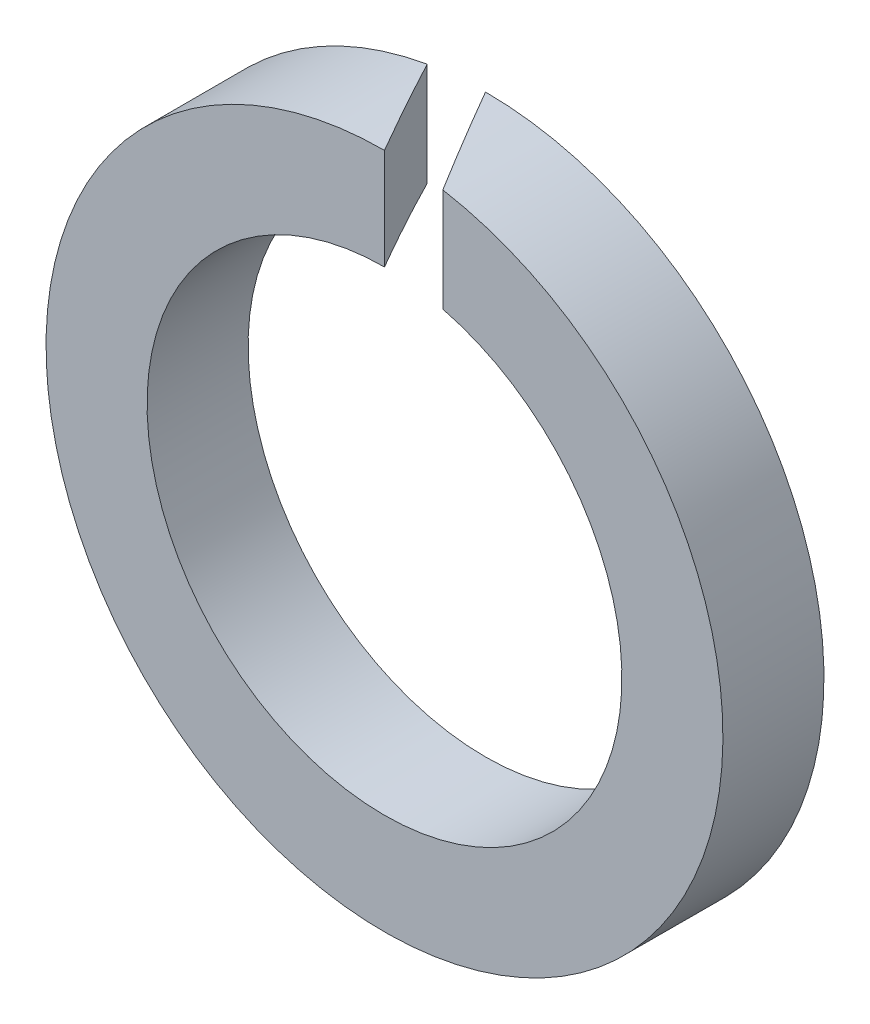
SolidWorks part; units mm, degrees
ref_plane "Front" through (0, 0, 0) normal (0, 0, 1) x (1, 0, 0)
ref_plane "Top" through (0, 0, 0) normal (0, 1, 0) x (1, 0, 0)
ref_plane "Right" through (0, 0, 0) normal (1, 0, 0) x (0, 0, -1)
sketch "Sketch1" plane through (0, 0, 0) normal (0, 0, 1) x (1, 0, 0)
  circle A0 centre (0, 0) radius 1.175
  circle A1 centre (0, 0) radius 1.675
  dimension "d" = 2.35
  dimension "b" = 0.5
extrude "Base-Extrude" add sketch "Sketch1" against normal blind 0.5
sketch "Sketch2" plane through (0, 0, 0) normal (0, 1, 0) x (1, 0, 0)
  line L0 (0, 0.5) -> (0.2887, 0)
  line L1 (0.2887, 0) -> (0, 0)
  line L3 (0, 0) -> (-0.2887, 0.5)
  line L5 (-0.2887, 0.5) -> (0, 0.5)
  line L7 (1.675, 0.5) -> (-1.675, 0.5) construction
  dimension "m" = 0.25
extrude "Cut-Extrude1" cut sketch "Sketch2" along normal through all
